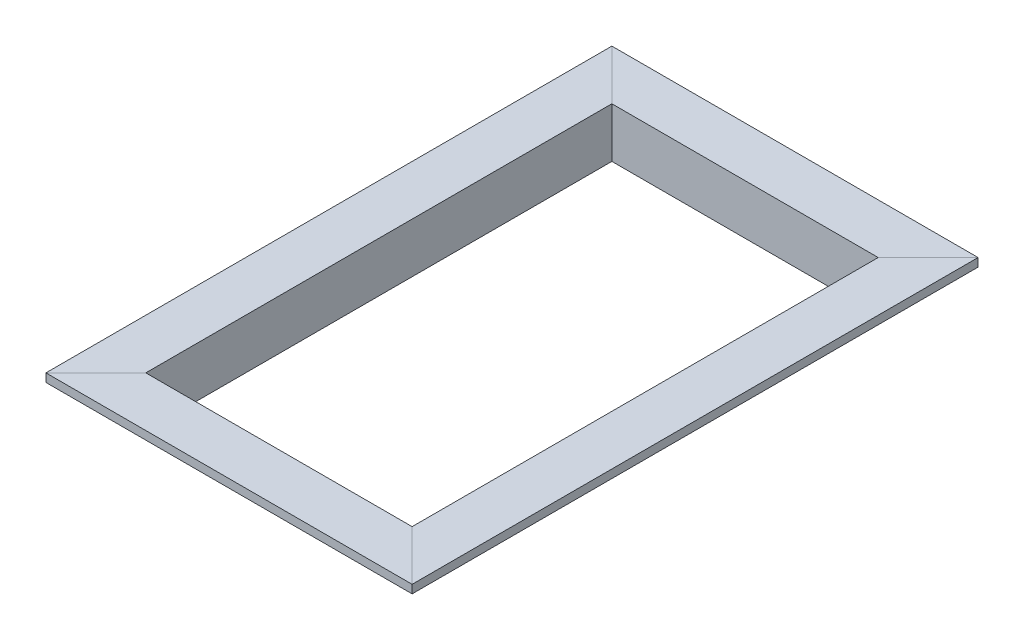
SolidWorks part; units mm, degrees
ref_plane "Front Plane" through (0, 0, 0) normal (0, 0, 1) x (1, 0, 0)
ref_plane "Top Plane" through (0, 0, 0) normal (0, 1, 0) x (1, 0, 0)
ref_plane "Right Plane" through (0, 0, 0) normal (1, 0, 0) x (0, 0, -1)
sketch "Sketch1" plane through (0, 0, 0) normal (0, 0, 1) x (1, 0, 0)
  line L0 (0, 0) -> (19.05, 0)
  line L1 (19.05, 0) -> (19.05, -19.05)
  line L2 (0, -3.175) -> (15.875, -3.175)
  line L3 (15.875, -3.175) -> (15.875, -19.05)
  line L4 (0, 0) -> (0, -3.175)
  line L5 (15.875, -19.05) -> (19.05, -19.05)
  line L6 (69.85, 0) -> (69.85, -19.05) construction
  line L7 (123.825, -19.05) -> (120.65, -19.05)
  line L8 (139.7, 0) -> (139.7, -3.175)
  line L9 (123.825, -3.175) -> (123.825, -19.05)
  line L10 (139.7, -3.175) -> (123.825, -3.175)
  line L11 (120.65, 0) -> (120.65, -19.05)
  line L12 (139.7, 0) -> (120.65, 0)
  dimension "D1" = 19.05
  dimension "D2" = 19.05
  dimension "D4" = 101.6
  dimension "D3" = 3.175
extrude "Boss-Extrude1" add sketch "Sketch1" along normal mid plane 177.8
sketch "Sketch2" plane through (0, 0, 0) normal (0, 1, 0) x (1, 0, 0)
  line L0 (139.7, -88.9) -> (139.7, 88.9) construction
  line L1 (0, 88.9) -> (139.7, 88.9)
  line L2 (0, 88.9) -> (0, 107.95)
  line L3 (0, 107.95) -> (139.7, 107.95)
  line L4 (139.7, 88.9) -> (139.7, 107.95)
  line L5 (0, -88.9) -> (139.7, -88.9)
  line L6 (0, -88.9) -> (0, -107.95)
  line L7 (0, -107.95) -> (139.7, -107.95)
  line L8 (139.7, -88.9) -> (139.7, -107.95)
  dimension "D1" = 19.05
  dimension "D2" = 19.05
extrude "Boss-Extrude2" add sketch "Sketch2" against normal up to surface (3.175 mm away)
sketch "Sketch3" plane through (0, -3.175, 0) normal (0, -1, 0) x (1, 0, 0)
  line L0 (123.825, 88.9) -> (123.825, -88.9) construction
  line L1 (15.875, 88.9) -> (123.825, 88.9)
  line L2 (15.875, 88.9) -> (15.875, 92.075)
  line L3 (15.875, 92.075) -> (123.825, 92.075)
  line L4 (123.825, 88.9) -> (123.825, 92.075)
  line L6 (15.875, -88.9) -> (123.825, -88.9)
  line L7 (15.875, -88.9) -> (15.875, -92.075)
  line L8 (15.875, -92.075) -> (123.825, -92.075)
  line L9 (123.825, -88.9) -> (123.825, -92.075)
  dimension "D1" = 3.175
  dimension "D2" = 3.175
extrude "Boss-Extrude3" add sketch "Sketch3" along normal up to surface (15.875 mm away)
sketch "Sketch4" plane through (0, 0, 0) normal (0, 1, 0) x (1, 0, 0)
  line L0 (0, 0) -> (139.7, 0) construction
  line L1 (139.7, -107.95) -> (139.7, 107.95) construction
  line L2 (69.85, 107.95) -> (69.85, -107.95) construction
  line L3 (139.7, 107.95) -> (0, 107.95) construction
  line L4 (0, -107.95) -> (139.7, -107.95) construction
  line L5 (0, 107.95) -> (19.05, 88.9) construction
  line L6 (19.05, 88.9) -> (24.6324, 83.3176) construction
  line L7 (-0.018, 107.932) -> (19.032, 88.882)
  line L8 (19.032, 88.882) -> (24.6144, 83.2996)
  line L9 (0.018, 107.968) -> (19.068, 88.918)
  line L10 (19.068, 88.918) -> (24.6504, 83.3356)
  line L11 (-0.018, 107.932) -> (0.018, 107.968)
  line L12 (24.6144, 83.2996) -> (24.6504, 83.3356)
  line L13 (120.65, 88.9) -> (115.0676, 83.3176) construction
  line L14 (139.7, 107.95) -> (120.65, 88.9) construction
  line L15 (115.0856, 83.2996) -> (115.0496, 83.3356)
  line L16 (139.718, 107.932) -> (139.682, 107.968)
  line L17 (120.632, 88.918) -> (115.0496, 83.3356)
  line L18 (139.682, 107.968) -> (120.632, 88.918)
  line L19 (120.668, 88.882) -> (115.0856, 83.2996)
  line L20 (139.718, 107.932) -> (120.668, 88.882)
  line L21 (139.7, -107.95) -> (120.65, -88.9) construction
  line L22 (120.65, -88.9) -> (115.0676, -83.3176) construction
  line L23 (19.05, -88.9) -> (24.6324, -83.3176) construction
  line L24 (0, -107.95) -> (19.05, -88.9) construction
  line L25 (139.718, -107.932) -> (120.668, -88.882)
  line L26 (120.668, -88.882) -> (115.0856, -83.2996)
  line L27 (139.682, -107.968) -> (120.632, -88.918)
  line L28 (120.632, -88.918) -> (115.0496, -83.3356)
  line L29 (139.718, -107.932) -> (139.682, -107.968)
  line L30 (115.0856, -83.2996) -> (115.0496, -83.3356)
  line L31 (24.6144, -83.2996) -> (24.6504, -83.3356)
  line L32 (-0.018, -107.932) -> (0.018, -107.968)
  line L33 (19.068, -88.918) -> (24.6504, -83.3356)
  line L34 (0.018, -107.968) -> (19.068, -88.918)
  line L35 (19.032, -88.882) -> (24.6144, -83.2996)
  line L36 (-0.018, -107.932) -> (19.032, -88.882)
  dimension "D1" = 0.0254
  dimension "D2" = 0.0254
extrude "Cut-Extrude1" cut sketch "Sketch4" against normal through all
